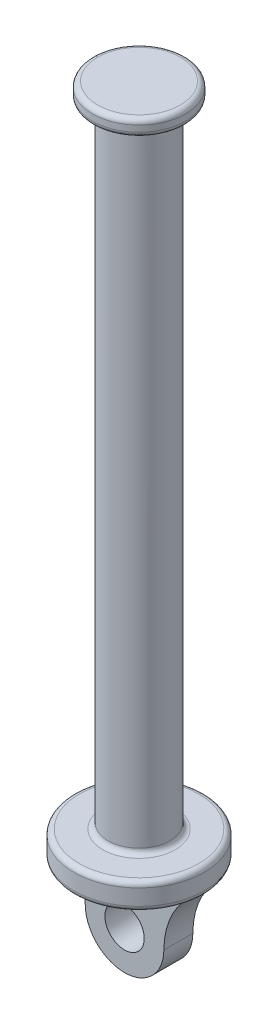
SolidWorks part; units mm, degrees
ref_plane "Front Plane" through (0, 0, 0) normal (0, 0, 1) x (1, 0, 0)
ref_plane "Top Plane" through (0, 0, 0) normal (0, 1, 0) x (1, 0, 0)
ref_plane "Right Plane" through (0, 0, 0) normal (1, 0, 0) x (0, 0, -1)
sketch "Sketch1" plane through (0, 0, 0) normal (0, 1, 0) x (1, 0, 0)
  circle A0 centre (0, 0) radius 15
  dimension "D1" = 30
extrude "Boss-Extrude1" add sketch "Sketch1" along normal blind 305
sketch "Sketch2" plane through (0, 305, 0) normal (0, 1, 0) x (1, 0, 0)
  circle A0 centre (0, 0) radius 22.5
  dimension "D1" = 45
extrude "Boss-Extrude2" add sketch "Sketch2" along normal blind 8
sketch "Sketch3" plane through (0, 0, 0) normal (0, -1, 0) x (1, 0, 0)
  circle A0 centre (0, 0) radius 31.5
  dimension "D1" = 63
extrude "Boss-Extrude3" add sketch "Sketch3" along normal blind 12.7
sketch "Sketch4" plane through (0, 0, 0) normal (0, 0, 1) x (1, 0, 0)
  line L0 (-28.5, -12.7) -> (28.5, -12.7)
  line L1 (-31.5, -12.7) -> (31.5, -12.7) construction
  line L2 (0, -12.7) -> (0, -37.7) construction
  circle A0 centre (0, -37.7) radius 9.5
  arc A1 (-18.9999, -37.7449) -> (18.9999, -37.7449) centre (0, -37.7) ccw
  arc A2 (28.5, -12.7) -> (18.9999, -37.7449) centre (56.9998, -37.8348) ccw
  arc A3 (-28.5, -12.7) -> (-18.9999, -37.7449) centre (-56.9998, -37.8348) cw
  point P5 (0, -12.7)
  dimension "D2" = 19
  dimension "D3" = 19
  dimension "D4" = 38
  dimension "D1" = 57
  dimension "D5" = 25
extrude "Boss-Extrude4" add sketch "Sketch4" along normal mid plane 14
fillet "Fillet1" radius 2.5 6 edges at (0, 0, 15) (0, 305, 15) (0, -12.7, -31.5) (0, 0, -31.5) (0, 305, 22.5) (0, 313, 22.5)
